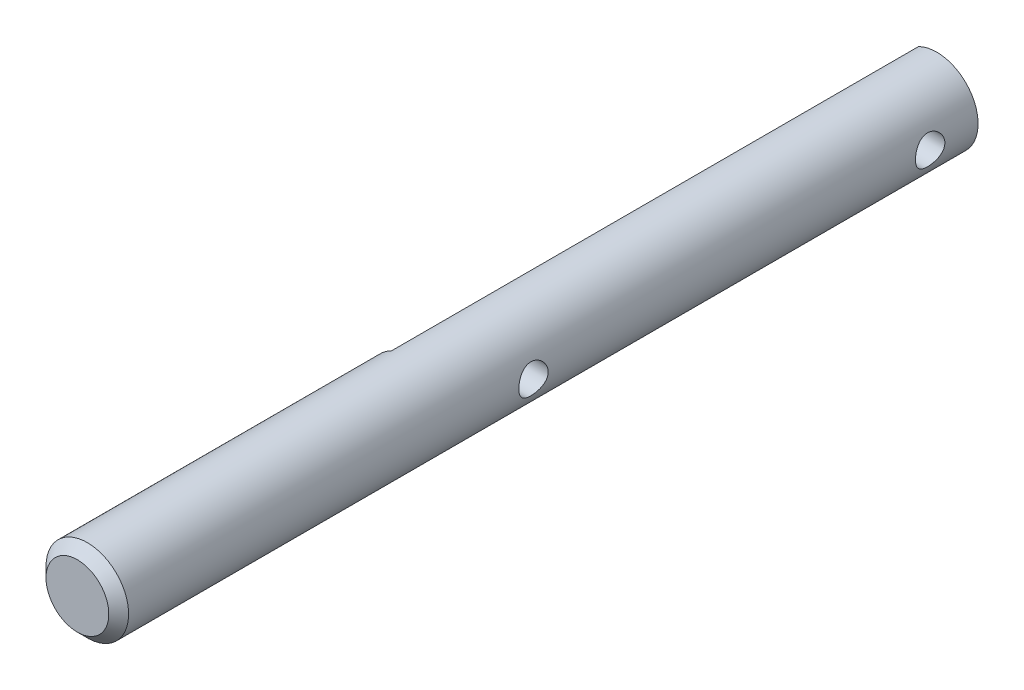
SolidWorks part; units mm, degrees
ref_plane "Front Plane" through (0, 0, 0) normal (0, 0, 1) x (1, 0, 0)
ref_plane "Top Plane" through (0, 0, 0) normal (0, 1, 0) x (1, 0, 0)
ref_plane "Right Plane" through (0, 0, 0) normal (1, 0, 0) x (0, 0, -1)
sketch "Sketch1" plane through (0, 0, 0) normal (0, 0, 1) x (1, 0, 0)
  circle A0 centre (0, 0) radius 3.175
  dimension "D1" = 6.35
extrude "Boss-Extrude1" add sketch "Sketch1" along normal blind 160.02
chamfer "Chamfer1" distance 0.762 angle 45 2 edges at (3.175, 0, 0) (3.175, 0, 160.02)
sketch "Sketch2" plane through (0, 0, 0) normal (1, 0, 0) x (0, 0, -1)
  line L1 (0, -2.413) -> (0, 2.413) construction
  line L2 (0, 0) -> (-160.02, 0) construction
  line L3 (-160.02, 2.413) -> (-160.02, -2.413) construction
  circle A0 centre (-13.843, 0) radius 1.1303
  circle A1 centre (-44.323, 0) radius 1.1303
  circle A2 centre (-97.663, 0) radius 1.1303
  circle A3 centre (-128.143, 0) radius 1.1303
  dimension "D2" = 2.2606
  dimension "D1" = 13.843
  dimension "D3" = 30.48
  dimension "D4" = 53.34
  dimension "D5" = 30.48
extrude "Cut-Extrude1" cut sketch "Sketch2" against normal through all and the other way through all
sketch "Sketch3" plane through (0, 0, 0) normal (1, 0, 0) x (0, 0, -1)
  line L0 (-0.762, 3.175) -> (-159.258, 3.175) construction
  line L1 (-7.493, 3.175) -> (-134.493, 3.175)
  line L2 (-7.493, 3.175) -> (-7.493, -3.175)
  line L3 (-7.493, -3.175) -> (-134.493, -3.175)
  line L4 (-134.493, 3.175) -> (-134.493, -3.175)
  line L5 (-44.323, 0) -> (-97.663, 0) construction
  line L6 (-70.993, 3.175) -> (-70.993, -3.175) construction
  point P13 (-70.993, 0)
  dimension "D1" = 127
extrude "Cut-Extrude2" cut sketch "Sketch3" along normal blind 1.778 from offset 3.175
sketch "Sketch4" plane through (0, 0, 0) normal (0, 0, -1) x (-1, 0, 0)
  circle A0 centre (0, 0) radius 3.175 construction
  circle A1 centre (0, 0) radius 3.175
extrude "Cut-Extrude3" cut sketch "Sketch4" against normal blind 93.98
